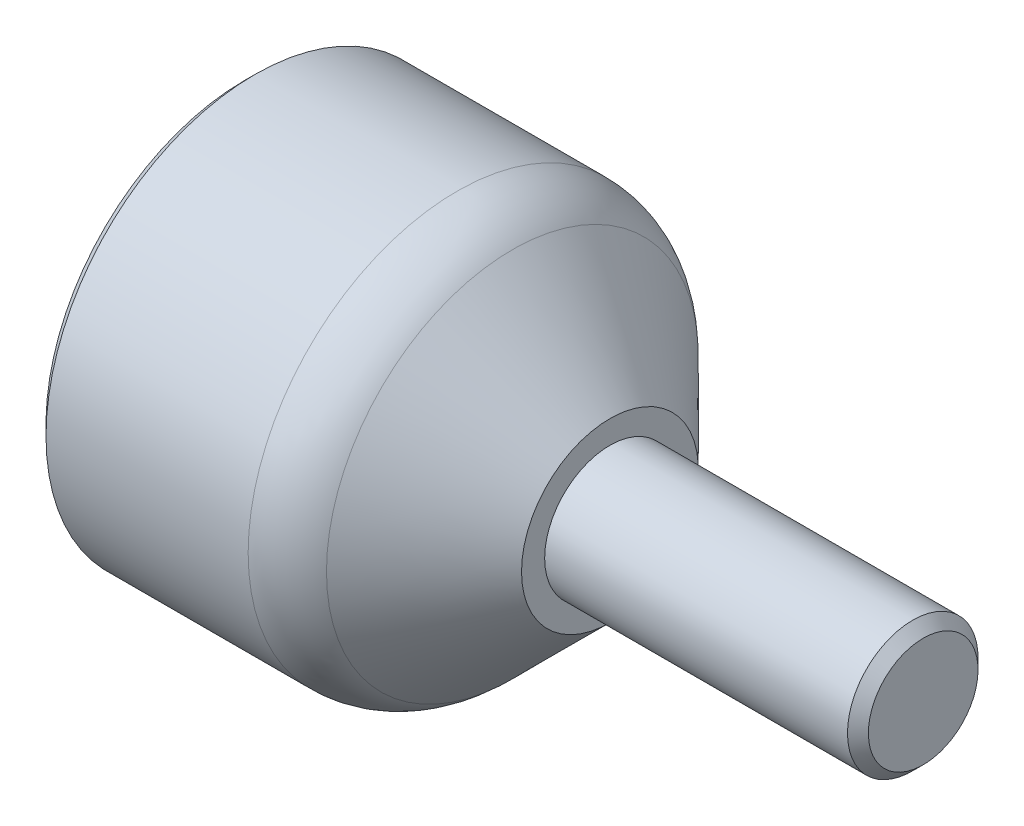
SolidWorks part; units mm, degrees
ref_plane "Plane1" through (0, 0, 0) normal (0, 0, 1) x (1, 0, 0)
ref_plane "Plane2" through (0, 0, 0) normal (0, 1, 0) x (1, 0, 0)
ref_plane "Plane3" through (0, 0, 0) normal (1, 0, 0) x (0, 0, -1)
sketch "Esquisse1" plane through (0, 0, 0) normal (0, 0, 1) x (1, 0, 0)
  line L0 (-19, 40) -> (21.7157, 40)
  line L1 (32.3223, 35.6066) -> (51, 16.9289)
  line L2 (51, 16.9289) -> (51, 12.5)
  line L3 (51, 12.5) -> (111, 12.5)
  line L4 (111, 12.5) -> (111, 0)
  line L5 (-19, 40) -> (-19, 34)
  line L6 (-19, 34) -> (19.2304, 34)
  line L7 (29.837, 29.6066) -> (40.6066, 18.837)
  line L8 (45, 8.2304) -> (45, 0)
  line L9 (45, 0) -> (111, 0)
  line L11 (-50, 0) -> (160, 0) construction
  arc A0 (21.7157, 40) -> (32.3223, 35.6066) centre (21.7157, 25) cw
  arc A1 (29.837, 29.6066) -> (19.2304, 34) centre (19.2304, 19) ccw
  arc A2 (45, 8.2304) -> (40.6066, 18.837) centre (30, 8.2304) ccw
  point P15 (27.9289, 40)
  dimension "D9" = 15
  dimension "D1" = 6
  dimension "D2" = 6
  dimension "D3" = 40
  dimension "D4" = 70
  dimension "D5" = 12.5
  dimension "D7" = 6
  dimension "D8" = 60
revolve "Base-Révolution" add sketch "Esquisse1" angle 360 about L11
sketch "Esquisse3" plane through (0, 0, 0) normal (0, 1, 0) x (1, 0, 0)
  circle A0 centre (0, 0) radius 7
  dimension "D1" = 14
extrude "Boss.-Extru.1" add sketch "Esquisse3" along normal up to next
pattern_circular "Répétition circulaire1" count 3 every 120 about axis through (-50, 0, 0) along (1, 0, 0)
sketch "Esquisse5" plane through (0, 0, 0) normal (1, 0, 0) x (0, 0, -1)
  circle A0 centre (0, 0) radius 14
  dimension "D2" = 28
extrude "Boss.-Extru.2" add sketch "Esquisse5" along normal mid plane 18
sketch "Esquisse6" plane through (-9, 0, 0) normal (-1, 0, 0) x (0, 0, 1)
  circle A0 centre (0, 0) radius 7
  dimension "D1" = 14
extrude "Enlèv. mat.-Extru.1" cut sketch "Esquisse6" against normal up to next
chamfer "Chanfrein1" distance 2 angle 45
chamfer "Chanfrein2" distance 2 angle 45
sketch "Esquisse7" plane through (9, 0, 0) normal (1, 0, 0) x (0, 0, -1)
  circle A0 centre (0, 0) radius 7
extrude "Boss.-Extru.3" add sketch "Esquisse7" against normal blind 9
